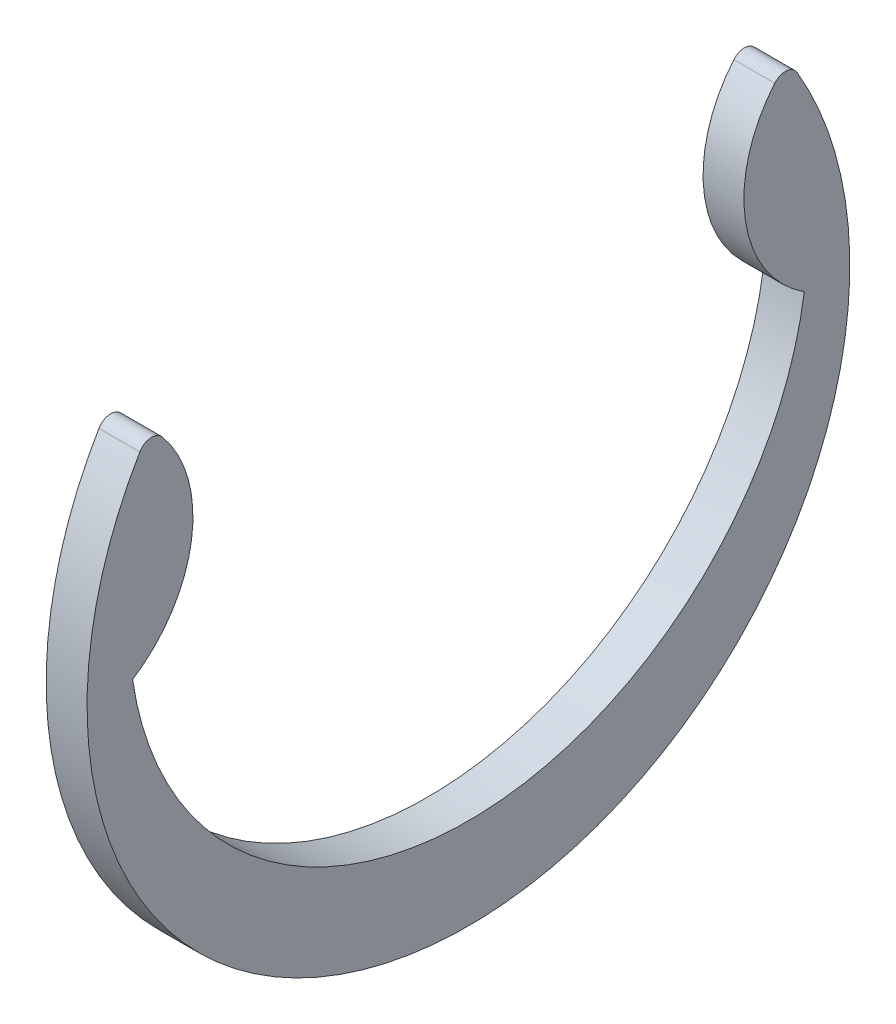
SolidWorks part; units mm, degrees
ref_plane "Front" through (0, 0, 0) normal (0, 0, 1) x (1, 0, 0)
ref_plane "Top" through (0, 0, 0) normal (0, 1, 0) x (1, 0, 0)
ref_plane "Right" through (0, 0, 0) normal (1, 0, 0) x (0, 0, -1)
sketch "Sketch1" plane through (0, 0, 0) normal (1, 0, 0) x (0, 0, -1)
  circle A0 centre (0, 0) radius 6.3119 construction
  arc A1 (-7.3025, 0) -> (7.3025, 0) centre (0, 1.0683) ccw
  circle A2 centre (0, 0) radius 8.2931 construction
  circle A3 centre (0, 0) radius 8.509 construction
  arc A4 (7.1462, 4.2079) -> (-7.1462, 4.2079) centre (0, 0) cw
  arc A5 (-6.66, 4.2483) -> (-7.3025, 0) centre (-8.8554, 2.4076) cw
  arc A6 (-7.1462, 4.2079) -> (-6.66, 4.2483) centre (-6.8889, 4.0564) cw
  arc A7 (7.1462, 4.2079) -> (6.66, 4.2483) centre (6.8889, 4.0564) ccw
  arc A8 (7.3025, 0) -> (6.66, 4.2483) centre (8.8554, 2.4076) cw
  arc A9 (6.66, 4.2483) -> (7.3025, 0) centre (0, 1.0683) cw construction
  dimension "D1" = 4.2079
  dimension "A" = 12.6238
  dimension "D2" = 14.605
  dimension "L" = 17.018
  dimension "OD" = 16.5862
extrude "Extrude1" add sketch "Sketch1" along normal mid plane 0.889
sketch "Sketch2" plane through (0, 0, 0) normal (0, 0, 1) x (1, 0, 0)
  line L0 (-2.4765, 0) -> (7.4295, 0)
  line L1 (7.4295, 0) -> (7.4295, -7.1374)
  line L3 (7.4295, -7.1374) -> (0.4953, -7.1374)
  line L4 (0.4953, -7.1374) -> (0.4953, -6.4389)
  line L5 (0.4953, -6.4389) -> (-0.4953, -6.4389)
  line L6 (-0.4953, -6.4389) -> (-0.4953, -7.1374)
  line L7 (-0.4953, -7.1374) -> (-2.4765, -7.1374) construction
  line L8 (-2.4765, -7.1374) -> (-2.4765, 0) construction
  line L9 (0, -6.4389) -> (0, 0) construction
  line L10 (7.4295, 0) -> (14.0551, 0) construction
  line L11 (-0.4953, -7.1374) -> (-2.1272, -7.1374)
  line L12 (-2.1272, -7.1374) -> (-2.4765, -6.7881)
  line L13 (-2.4765, -6.7881) -> (-2.4765, 0)
  point P14 (-0.4953, -6.7881)
  dimension "Dg" = 12.8778
  dimension "Ds" = 14.2748
  dimension "D2" = 9.906
  dimension "W" = 0.9906
  dimension "D3" = 2.4765
  dimension "D4" = 45
revolve "Revolve1" [suppressed] add sketch "Sketch2" angle 360 about L10
equation "\"D2@Sketch2\" = \"W@Sketch2\"*10"
equation "\"D3@Sketch2\" = \"D2@Sketch2\"/4"
equation "\"D1@Sketch1\" = \"A@Sketch1\"/3"
equation "\"D2@Sketch1\" = (\"OD@Sketch1\"+\"A@Sketch1\")/2"
